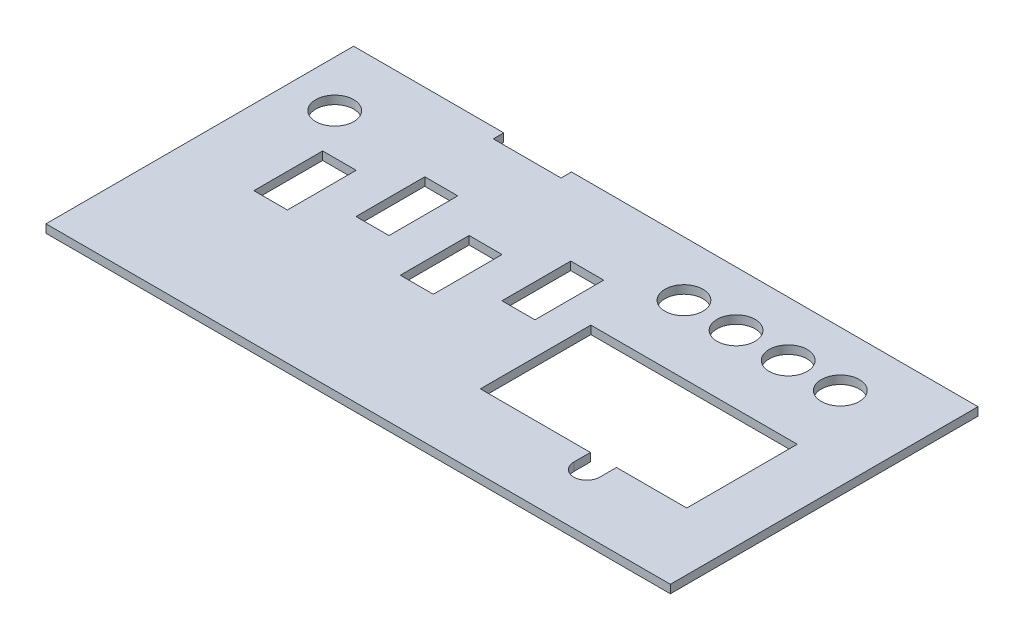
SolidWorks part; units mm, degrees
ref_plane "X_Y" through (0, 0, 0) normal (0, 0, 1) x (1, 0, 0)
ref_plane "Z_X" through (0, 0, 0) normal (0, 1, 0) x (1, 0, 0)
ref_plane "Y_Z" through (0, 0, 0) normal (1, 0, 0) x (0, 0, -1)
sketch "Sketch1" plane through (0, 0, 0) normal (0, 1, 0) x (1, 0, 0)
  line L1 (-75, -35) -> (75, -35)
  line L2 (-75, -35) -> (-75, 35)
  line L3 (-75, 35) -> (75, 35)
  line L4 (75, -35) -> (75, 35)
  line L5 (-75, -35) -> (75, 35) construction
  line L6 (-75, 35) -> (75, -35) construction
  point P0 (0, 0)
  dimension "D1" = 70
  dimension "D2" = 150
extrude "Boss-Extrude1" add sketch "Sketch1" along normal blind 1.5875
sketch "Sketch3" plane through (0, 0, 0) normal (0, -1, 0) x (1, 0, 0)
  line L9 (59.895, -30.02) -> (59.895, 29)
  line L10 (59.895, 29) -> (-59.895, 29)
  line L11 (-59.895, 29) -> (-59.895, -30.02)
  line L12 (59.895, -30.02) -> (59.895, 29)
  line L13 (59.895, 29) -> (-59.895, 29)
  line L14 (-59.895, 29) -> (-59.895, -30.02)
  line L162 (-31.1, -30.02) -> (-31.1, -28.02)
  line L163 (-69.0817, -30.02) -> (-31.1, -30.02)
  line L164 (-69.0817, 27.1759) -> (-69.0817, -30.02)
  line L165 (62.2359, 34.0217) -> (-62.2359, 34.0217)
  line L170 (69.0817, -30.02) -> (69.0817, 27.1759)
  line L171 (-18.1, -30.02) -> (69.0817, -30.02)
  line L172 (-18.1, -28.02) -> (-18.1, -30.02)
  line L173 (-31.1, -28.02) -> (-18.1, -28.02)
  line L174 (-31.1, -30.02) -> (-31.1, -28.02)
  line L175 (-59.895, -30.02) -> (-31.1, -30.02)
  line L183 (-18.1, -30.02) -> (59.895, -30.02)
  line L184 (-18.1, -28.02) -> (-18.1, -30.02)
  line L185 (-31.1, -28.02) -> (-18.1, -28.02)
  ellipse E2 centre (-62.2276, 27.1676) end of major axis (-67.0772, 32.0172) minor radius 6.85 (-62.2359, 34.0217) -> (-69.0817, 27.1759) ccw
  ellipse E3 centre (62.2276, 27.1676) end of major axis (57.378, 22.318) minor radius 6.85 (69.0817, 27.1759) -> (62.2359, 34.0217) ccw
  dimension "D1" = 0
  dimension "D2" = 1
extrude "Cut-Extrude1" cut sketch "Sketch3" against normal blind 10 flip side to cut
sketch "Sketch6" plane through (0, 1.5875, 0) normal (0, 1, 0) x (1, 0, 0)
  line L12 (48.8, -14.76) -> (9.2, -14.76)
  line L13 (8.5, -15.46) -> (29.32, -15.46) construction
  line L14 (-17.3655, 9.6431) -> (-17.3655, -3.5534)
  line L15 (-11.0345, 9.6431) -> (-17.3655, 9.6431)
  line L16 (-17.3655, -3.5534) -> (-11.0345, -3.5534)
  line L17 (-11.0345, -3.5534) -> (-11.0345, 9.6431)
  line L18 (-17.3655, 9.6431) -> (-17.3655, -3.5534)
  line L19 (-11.0345, 9.6431) -> (-17.3655, 9.6431)
  line L20 (-17.3655, -3.5534) -> (-11.0345, -3.5534)
  line L21 (-11.0345, -3.5534) -> (-11.0345, 9.6431)
  line L23 (9.2, 6.44) -> (9.2, -15.46)
  line L24 (48.8, 6.44) -> (9.2, 6.44)
  line L25 (48.8, -15.46) -> (48.8, 6.44)
  line L26 (9.2, 6.44) -> (9.2, -14.76)
  line L27 (48.8, 6.44) -> (9.2, 6.44)
  line L28 (48.8, -14.76) -> (48.8, 6.44)
  line L32 (-31.3655, 1.9466) -> (-25.0345, 1.9466)
  line L33 (-31.3655, 15.1431) -> (-31.3655, 1.9466)
  line L34 (-25.0345, 15.1431) -> (-31.3655, 15.1431)
  line L35 (-25.0345, 1.9466) -> (-25.0345, 15.1431)
  line L60 (-31.3655, 1.9466) -> (-25.0345, 1.9466)
  line L61 (-31.3655, 15.1431) -> (-31.3655, 1.9466)
  line L62 (-25.0345, 15.1431) -> (-31.3655, 15.1431)
  line L63 (-25.0345, 1.9466) -> (-25.0345, 15.1431)
  line L74 (-45.46, -3.5534) -> (-39.0345, -3.5534)
  line L75 (-45.46, 9.6431) -> (-45.46, -3.5534)
  line L76 (-39.0345, 9.6431) -> (-45.46, 9.6431)
  line L77 (-39.0345, -3.5534) -> (-39.0345, 9.6431)
  line L78 (-45.46, -3.5534) -> (-39.0345, -3.5534)
  line L79 (-45.46, 9.6431) -> (-45.46, -3.5534)
  line L80 (-39.0345, 9.6431) -> (-45.46, 9.6431)
  line L81 (-39.0345, -3.5534) -> (-39.0345, 9.6431)
  line L273 (-3.3655, 15.1431) -> (-3.3655, 1.9466)
  line L274 (2.9655, 15.1431) -> (-3.3655, 15.1431)
  line L275 (-3.3655, 1.9466) -> (2.9655, 1.9466)
  line L276 (2.9655, 1.9466) -> (2.9655, 15.1431)
  line L277 (-3.3655, 15.1431) -> (-3.3655, 1.9466)
  line L278 (2.9655, 15.1431) -> (-3.3655, 15.1431)
  line L279 (-3.3655, 1.9466) -> (2.9655, 1.9466)
  line L280 (2.9655, 1.9466) -> (2.9655, 15.1431)
  circle A2 centre (14, 19.5) radius 3.65
  circle A3 centre (14, 19.5) radius 3.65
  circle A4 centre (64.495, 5.21) radius 3.6
  circle A5 centre (64.495, 5.21) radius 3.6
  circle A7 centre (-64.495, 5.21) radius 3.6
  circle A8 centre (-64.495, 5.21) radius 3.6
  circle A32 centre (-51, 17.5) radius 3.65
  circle A33 centre (-51, 17.5) radius 3.65
  circle A141 centre (24, 19.5) radius 3.65
  circle A142 centre (24, 19.5) radius 3.65
  circle A144 centre (34, 19.5) radius 3.65
  circle A145 centre (34, 19.5) radius 3.65
  circle A147 centre (44, 19.5) radius 3.65
  circle A148 centre (44, 19.5) radius 3.65
  dimension "D13" = 0.7
  dimension "D2" = 0.7
  dimension "D3" = 0.7
  dimension "D4" = 0.7
  dimension "D5" = 0.7
  dimension "D6" = 0.7
  dimension "D7" = 0.7
  dimension "D8" = 0.7
  dimension "D9" = 0.7
  dimension "D10" = 0.7
  dimension "D11" = 0
  dimension "D12" = 0
  dimension "D14" = 0.7
extrude "Cut-Extrude2" cut sketch "Sketch6" against normal through all
sketch "Sketch7" plane through (0, 0, 0) normal (0, -1, 0) x (1, 0, 0)
  line L7 (30.32, 14.76) -> (35.32, 14.76)
  line L11 (9.2, 14.76) -> (48.8, 14.76) construction
  line L16 (35.32, 17.96) -> (35.32, 15.46)
  line L17 (30.32, 15.46) -> (30.32, 17.96)
  line L18 (35.32, 17.96) -> (35.32, 14.76)
  line L19 (30.32, 14.76) -> (30.32, 17.96)
  arc A10 (35.32, 17.96) -> (30.32, 17.96) centre (32.82, 17.96) ccw
  arc A11 (35.32, 17.96) -> (30.32, 17.96) centre (32.82, 17.96) ccw
  dimension "D1" = 1
extrude "Cut-Extrude3" cut sketch "Sketch7" against normal through all
